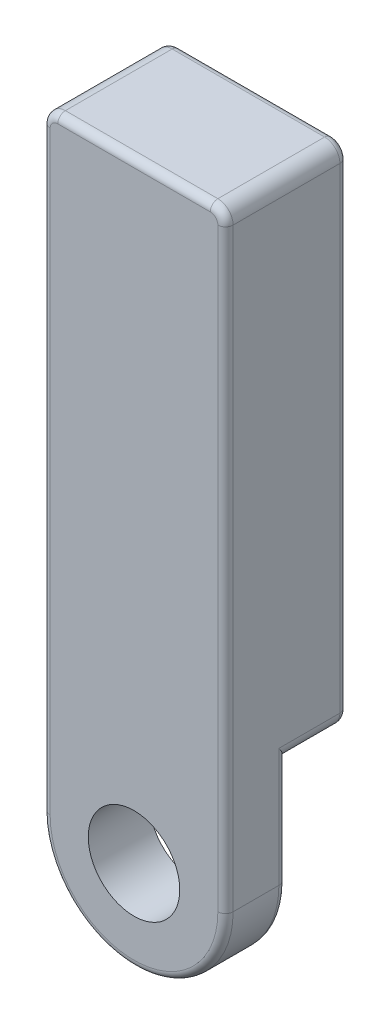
SolidWorks part; units mm, degrees
ref_plane "Front" through (0, 0, 0) normal (0, 0, 1) x (1, 0, 0)
ref_plane "Top" through (0, 0, 0) normal (0, 1, 0) x (1, 0, 0)
ref_plane "Right" through (0, 0, 0) normal (1, 0, 0) x (0, 0, -1)
sketch "Sketch1" plane through (0, 0, 0) normal (0, 0, 1) x (1, 0, 0)
  line L0 (-19.05, 0) -> (-19.05, 127)
  line L1 (-19.05, 127) -> (19.05, 127)
  line L2 (19.05, 127) -> (19.05, 0)
  arc A0 (19.05, 0) -> (-19.05, 0) centre (0, 0) cw
  circle A1 centre (0, 0) radius 9.525
  dimension "D2" = 38.1
  dimension "D3" = 19.05
  dimension "D1" = 127
extrude "Base-Extrude" add sketch "Sketch1" along normal blind 25.4
sketch "Sketch2" plane through (0, 0, 0) normal (0, 0, -1) x (-1, 0, 0)
  circle A0 centre (0, 0) radius 26.1937
  dimension "D1" = 52.3875
extrude "Cut-Extrude1" cut sketch "Sketch2" against normal blind 12.7
fillet "Fillet1" radius 3.175 4 edges at (-19.05, 17.978, 6.35) (19.05, 17.978, 6.35) (19.05, 127, 12.7) (-19.05, 127, 12.7)
fillet "Fillet2" radius 1.5875 17 edges at (0, -19.05, 12.7) (19.05, 12.3542, 12.7) (-19.05, 12.3542, 12.7) (0, 26.1938, 0) (-19.05, 74.2667, 0) (0, 127, 0) (19.05, 74.2667, 0) (-18.1201, 126.0701, 0) (18.1201, 126.0701, 0) (17.3968, 21.9219, 0) (-17.3968, 21.9219, 0) (19.05, 61.9125, 25.4) (0, -19.05, 25.4) (0, 127, 25.4) (-18.1201, 126.0701, 25.4) (18.1201, 126.0701, 25.4) (-19.05, 61.9125, 25.4)
